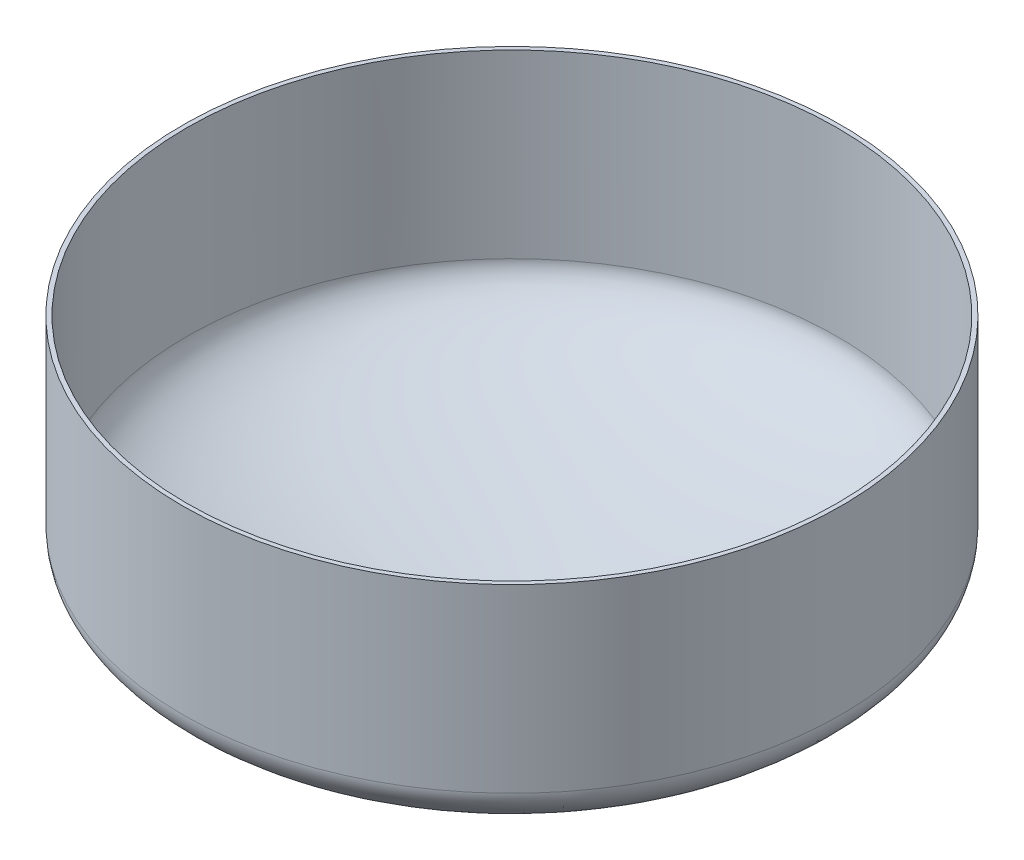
SolidWorks part; units mm, degrees
ref_plane "Vorne" through (0, 0, 0) normal (0, 0, 1) x (1, 0, 0)
ref_plane "Oben" through (0, 0, 0) normal (0, 1, 0) x (1, 0, 0)
ref_plane "Rechts" through (0, 0, 0) normal (1, 0, 0) x (0, 0, -1)
sketch "Skizze1" plane through (0, 0, 0) normal (1, 0, 0) x (0, 0, -1)
  line L0 (0, 182.5319) -> (0, -33.248) construction
  line L1 (190, 165) -> (0, 165)
  line L2 (0, 165) -> (0, 0)
  line L3 (0, 0) -> (30, 0)
  line L5 (190, 165) -> (190, 60.7998)
  ellipse E2 centre (-187.7804, 60.7998) end of major axis (190, 60.7998) minor radius 74.4079 (30, 0) -> (190, 60.7998) ccw
  dimension "D1" = 30
  dimension "D8" = 104.2002
  dimension "D2" = 165
  dimension "D3" = 380
revolve "Rotation1" add sketch "Skizze1" angle 360 about L0
shell "Wandung1" thickness 2.5
sketch "Skizze2" plane through (0, 0, 0) normal (0, -1, 0) x (1, 0, 0)
  circle A0 centre (0, 0) radius 9.25
  dimension "D1" = 18.5
extrude "Linear austragen1" cut sketch "Skizze2" against normal through all
sketch "Skizze3" plane through (0, 0, 0) normal (0, 0, 1) x (1, 0, 0)
  line L0 (0, 377.2853) -> (97.8508, 12.1012) construction
  line L1 (0, -77.766) -> (0, 246.7317) construction
  line L2 (0, 0) -> (0, 377.2853) construction
  ellipse E0 centre (-187.7804, 60.7998) end of major axis (190, 60.7998) minor radius 74.4079 (30, 0) -> (190, 60.7998) ccw construction
  dimension "D1" = 15
ref_plane "Ebene1" through (97.8508, 12.1012, 0) normal (0.2219, -0.9751, 0) x (0.9751, 0.2219, 0)
sketch "Skizze4" plane through (97.8508, 12.1012, 0) normal (0.2219, -0.9751, 0) x (0.9751, 0.2219, 0)
  line L0 (-14.3909, 0) -> (0, 0) construction
  circle A0 centre (0, 0) radius 15
  dimension "D1" = 30
extrude "Linear austragen2" cut sketch "Skizze4" against normal through all
